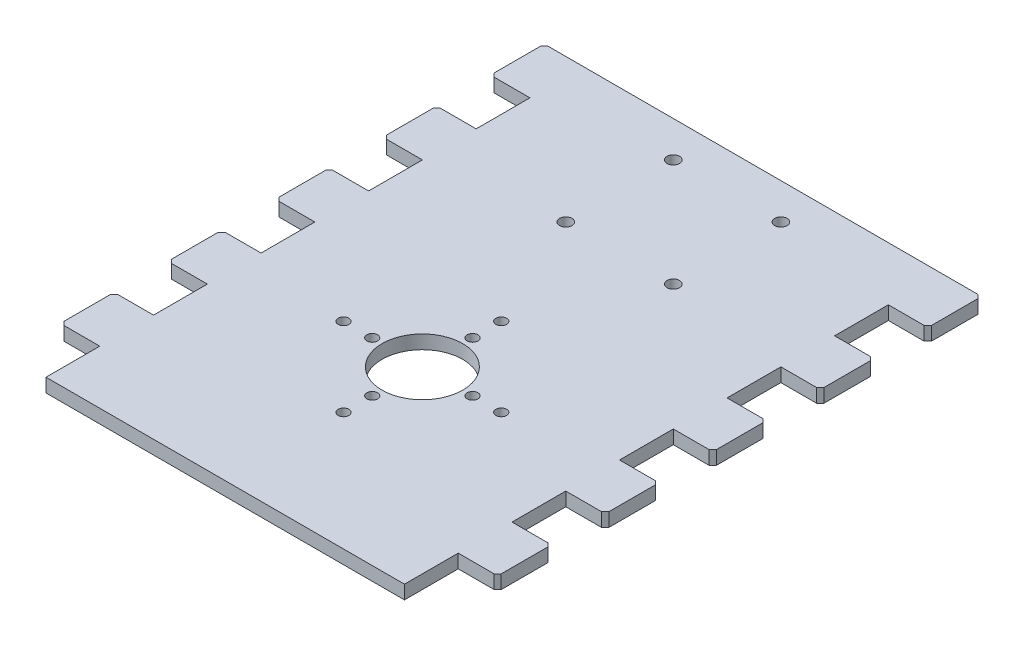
SolidWorks part; units mm, degrees
ref_plane "Front Plane" through (0, 0, 0) normal (0, 0, 1) x (1, 0, 0)
ref_plane "Top Plane" through (0, 0, 0) normal (0, 1, 0) x (1, 0, 0)
ref_plane "Right Plane" through (0, 0, 0) normal (1, 0, 0) x (0, 0, -1)
sketch "panel" plane through (0, 0, 0) normal (0, 1, 0) x (1, 0, 0)
  line L0 (0, 130) -> (100, 130) construction
  line L1 (0, 0) -> (100, 0)
  line L2 (0, 0) -> (0, 150)
  line L3 (0, 150) -> (100, 150)
  line L4 (100, 0) -> (100, 150)
  line L5 (0, 95) -> (100, 95) construction
  line L6 (0, 55) -> (100, 55) construction
  line L7 (0, 20) -> (100, 20) construction
  line L8 (50, 150) -> (50, 0) construction
  line L9 (0, 75) -> (100, 75) construction
  circle A0 centre (50, 55) radius 11.25
  circle A1 centre (50, 69) radius 1.5
  circle A2 centre (50, 77) radius 1.5
  circle A3 centre (64, 55) radius 1.5
  circle A4 centre (72, 55) radius 1.5
  circle A5 centre (50, 41) radius 1.5
  circle A6 centre (50, 33) radius 1.5
  circle A7 centre (36, 55) radius 1.5
  circle A8 centre (28, 55) radius 1.5
  circle A9 centre (35, 140) radius 1.75
  circle A10 centre (65, 140) radius 1.75
  circle A11 centre (65, 110) radius 1.75
  circle A12 centre (35, 110) radius 1.75
  point P36 (50, 55)
extrude "panelx" add sketch "panel" along normal blind 3.81
sketch "tabs" plane through (0, 3.81, 0) normal (0, 1, 0) x (1, 0, 0)
  line L0 (50, 150) -> (50, 0) construction
  line L1 (100, 150) -> (0, 150) construction
  line L2 (-11, 150) -> (-11, 135)
  line L3 (100, 150) -> (111, 150)
  line L4 (100, 150) -> (100, 135)
  line L5 (100, 135) -> (111, 135)
  line L6 (111, 150) -> (111, 135)
  line L7 (0, 135) -> (-11, 135)
  line L8 (0, 150) -> (0, 135)
  line L9 (0, 150) -> (-11, 150)
  line L10 (-11, 120) -> (-11, 105)
  line L11 (100, 120) -> (111, 120)
  line L12 (100, 120) -> (100, 105)
  line L13 (100, 105) -> (111, 105)
  line L14 (111, 120) -> (111, 105)
  line L15 (0, 105) -> (-11, 105)
  line L16 (0, 120) -> (0, 105)
  line L17 (0, 120) -> (-11, 120)
  line L18 (-11, 90) -> (-11, 75)
  line L19 (100, 90) -> (111, 90)
  line L20 (100, 90) -> (100, 75)
  line L21 (100, 75) -> (111, 75)
  line L22 (111, 90) -> (111, 75)
  line L23 (0, 75) -> (-11, 75)
  line L24 (0, 90) -> (0, 75)
  line L25 (0, 90) -> (-11, 90)
  line L26 (-11, 60) -> (-11, 45)
  line L27 (100, 60) -> (111, 60)
  line L28 (100, 60) -> (100, 45)
  line L29 (100, 45) -> (111, 45)
  line L30 (111, 60) -> (111, 45)
  line L31 (0, 45) -> (-11, 45)
  line L32 (0, 60) -> (0, 45)
  line L33 (0, 60) -> (-11, 60)
  line L34 (-11, 30) -> (-11, 15)
  line L35 (100, 30) -> (111, 30)
  line L36 (100, 30) -> (100, 15)
  line L37 (100, 15) -> (111, 15)
  line L38 (111, 30) -> (111, 15)
  line L39 (0, 15) -> (-11, 15)
  line L40 (0, 30) -> (0, 15)
  line L41 (0, 30) -> (-11, 30)
  dimension "D1" = 5
  dimension "3x thick" = 11
  dimension "tab" = 15
extrude "Boss-Extrude2" add sketch "tabs" against normal up to surface (3.81 mm away)
chamfer "Chamfer1" distance 1 angle 45 20 edges at (-11, 1.905, -150) (-11, 1.905, -135) (-11, 1.905, -120) (-11, 1.905, -105) (-11, 1.905, -90) (-11, 1.905, -75) (-11, 1.905, -60) (-11, 1.905, -45) (-11, 1.905, -30) (-11, 1.905, -15) (111, 1.905, -15) (111, 1.905, -30) (111, 1.905, -45) (111, 1.905, -60) (111, 1.905, -75) (111, 1.905, -90) (111, 1.905, -105) (111, 1.905, -120) (111, 1.905, -135) (111, 1.905, -150)
equation "\"D1@panel\" = \"screw@panel\""
equation "\"D2@panel\" = \"edge@panel\""
